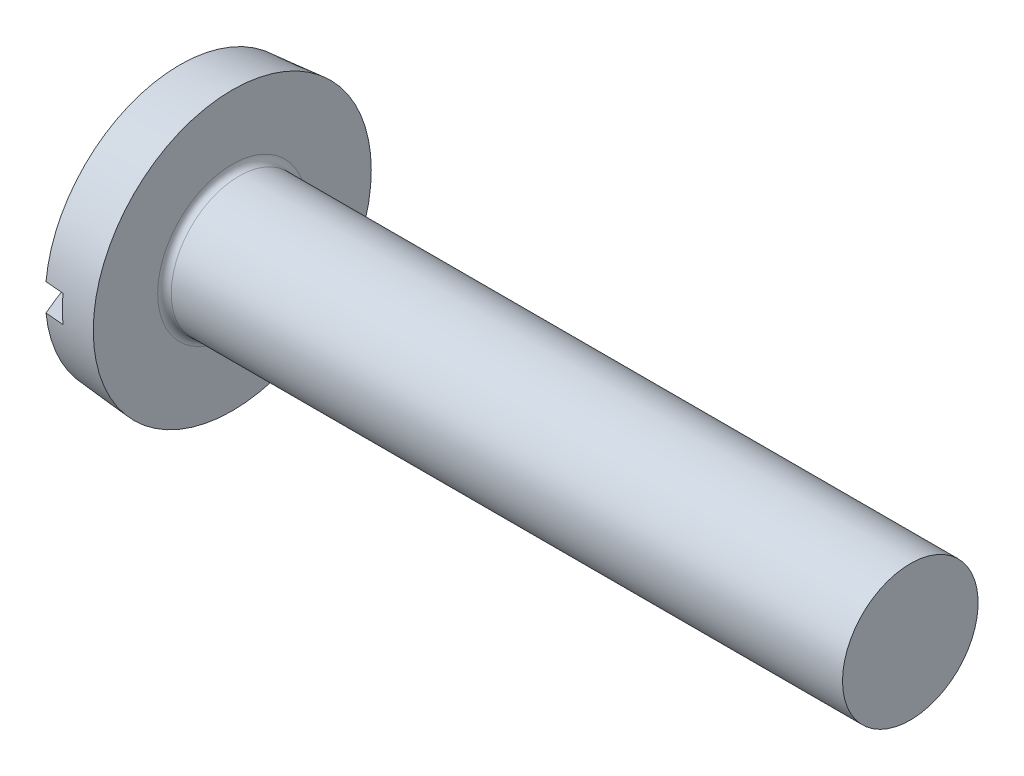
SolidWorks part; units mm, degrees
ref_plane "Front Plane" through (0, 0, 0) normal (0, 0, 1) x (1, 0, 0)
ref_plane "Top Plane" through (0, 0, 0) normal (0, 1, 0) x (1, 0, 0)
ref_plane "Right Plane" through (0, 0, 0) normal (1, 0, 0) x (0, 0, -1)
sketch "BodySke" plane through (0, 0, 0) normal (0, 0, 1) x (1, 0, 0)
  line L0 (0, 0) -> (120.5141, 0) construction
  line L1 (0, 0) -> (0, 50.5629) construction
  line L2 (4.8, 8.2) -> (4.8, 4)
  line L3 (4.8, 4) -> (44.8, 4)
  line L4 (44.8, 4) -> (44.8, 0)
  line L5 (0, 0) -> (44.8, 0)
  line L6 (4.8, 8.2) -> (1.7, 7.9288)
  line L7 (6.05, 10.4207) -> (6.05, -3.1796) construction
  line L8 (14.8, 9.5609) -> (14.8, -6.7938) construction
  arc A0 (0, 0) -> (1.7, 7.9288) centre (19.3399, 0) cw
  point P14 (44.8, 3.3095)
  dimension "Diameter" = 8
  dimension "Head_height" = 3.1
  dimension "Length" = 40
  dimension "Head_dia" = 16.4
  dimension "Advance" = 1.25
  dimension "Thread_length" = 30
  dimension "Thread_minor" = 6.619
  dimension "Head_binding" = 1.7
  dimension "Head_side_angle" = 5
revolve "BaseBody" add sketch "BodySke" angle 360 about L0
fillet "Fillet1" radius 0.4 1 edges at (4.8, 0, 4)
sketch "SlotSke" plane through (0, 0, 0) normal (1, 0, 0) x (0, 0, -1)
  line L1 (8.2, 0.8) -> (-8.2, 0.8)
  line L2 (8.2, 0.8) -> (8.2, -0.8)
  line L3 (8.2, -0.8) -> (-8.2, -0.8)
  line L4 (-8.2, 0.8) -> (-8.2, -0.8)
  dimension "D1" = 16.4
  dimension "D2" = 8.2
  dimension "Slot_width" = 1.6
  dimension "D4" = 0.8
extrude "Slot" cut sketch "SlotSke" along normal blind 2.8
sketch "ThdSchSke" plane through (0, 0, 0) normal (0, 0, 1) x (1, 0, 0)
  line L0 (0, 0) -> (54.7976, 0) construction
  line L1 (44.4013, 4.7973) -> (44.4013, 4)
  line L2 (44.4013, 4.7973) -> (45.1987, 4.7973)
  line L3 (45.1987, 4.7973) -> (45.1987, 4)
  line L4 (45.1987, 4) -> (44.8, 3.3095)
  line L5 (44.8, 3.3095) -> (44.4013, 4)
  line L6 (4.8, 4) -> (44.8, 4) construction
revolve "ThreadSchematic" [suppressed] cut sketch "ThdSchSke" angle 360 about L0
pattern_linear "ThdSchPat" [suppressed] count 24 along (1, 0, 0)
equation "\"Thread_minor@ThreadCosmetic\" = \"Thread_minor@BodySke\""
equation "\"D1@SlotSke\" = \"Head_dia@BodySke\""
equation "\"D2@SlotSke\" = \"D1@SlotSke\" / 2"
equation "\"D4@SlotSke\" = \"Slot_width@SlotSke\" / 2"
equation "\"Advance@ThdSchPat\" = \"Advance@BodySke\""
equation "\"D1@ThdSchPat\" =  int( \"Thread_length@BodySke\" / \"Advance@BodySke\" ) "
